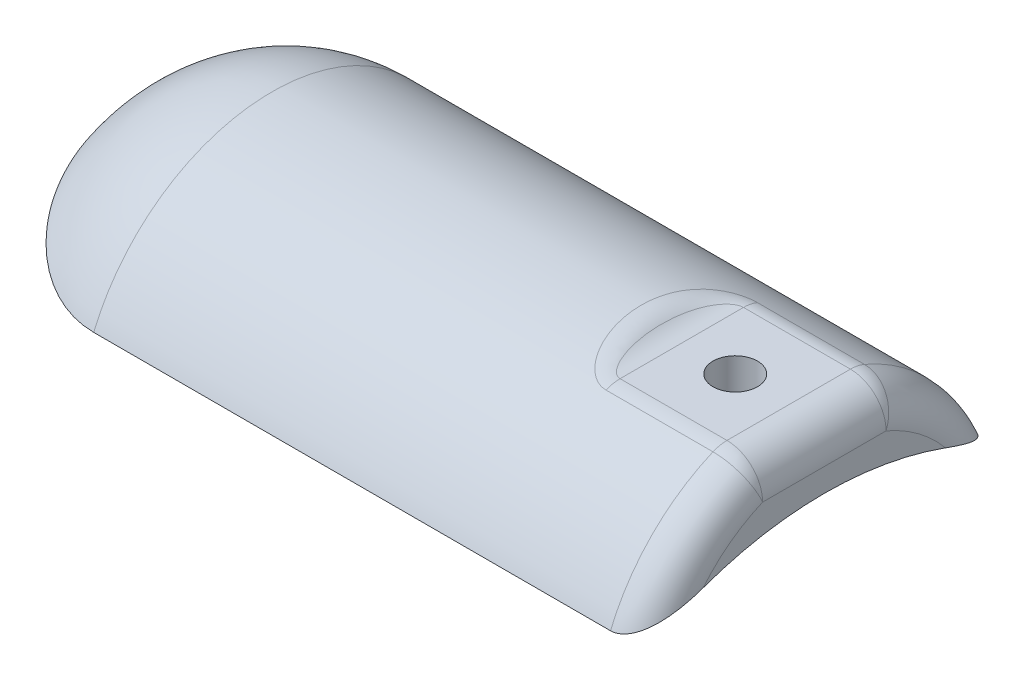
SolidWorks part; units mm, degrees
ref_plane "Front Plane" through (0, 0, 0) normal (0, 0, 1) x (1, 0, 0)
ref_plane "Top Plane" through (0, 0, 0) normal (0, 1, 0) x (1, 0, 0)
ref_plane "Right Plane" through (0, 0, 0) normal (1, 0, 0) x (0, 0, -1)
sketch "Sketch2" plane through (0, 0, 0) normal (1, 0, 0) x (0, 0, -1)
  line L0 (-12.7, 0) -> (12.7, 0) construction
  arc A0 (-12.7, 0) -> (12.7, 0) centre (0, -21.997) cw
  arc A1 (-12.7, 0) -> (12.7, 0) centre (0, -5.2402) cw
  dimension "D1" = 25.4
  dimension "D2" = 25.4
extrude "Boss-Extrude1" add sketch "Sketch2" along normal blind 50.8
sketch "Sketch3" plane through (50.8, 0, 0) normal (1, 0, 0) x (0, 0, -1)
  line L1 (4.8913, 7.5982) -> (-4.8913, 7.5982)
  line L2 (4.8913, 7.5982) -> (4.8913, 8.4984)
  line L3 (4.8913, 8.4984) -> (-4.8913, 8.4984)
  line L4 (-4.8913, 7.5982) -> (-4.8913, 8.4984)
  arc A0 (12.7, 0) -> (-12.7, 0) centre (0, -5.2402) ccw construction
  point P4 (0, 8.4984)
extrude "Cut-Extrude1" cut sketch "Sketch3" against normal blind 12.7
fillet "Fillet1" radius 2.54 1 edges at (38.1, 7.5982, 0)
fillet "Fillet3" radius 2.54 6 edges at (38.7002, 8.4984, 0) (50.8, 4.6063, -9.5811) (50.8, 4.6063, 9.5811) (50.8, 7.5982, 0) (45.72, 7.5982, 4.8913) (45.72, 7.5982, -4.8913)
sketch "Sketch4" plane through (0, 7.5982, 0) normal (0, 1, 0) x (1, 0, 0)
  line L0 (40.64, 4.3991) -> (44.45, 0) construction
  line L1 (44.45, 0) -> (48.26, -4.3991) construction
  circle A0 centre (44.45, 0) radius 1.5875
  dimension "D1" = 3.175
extrude "Cut-Extrude2" cut sketch "Sketch4" against normal through all
fillet "Fillet4" radius 11.43 1 edges at (0, 8.4984, 0)
